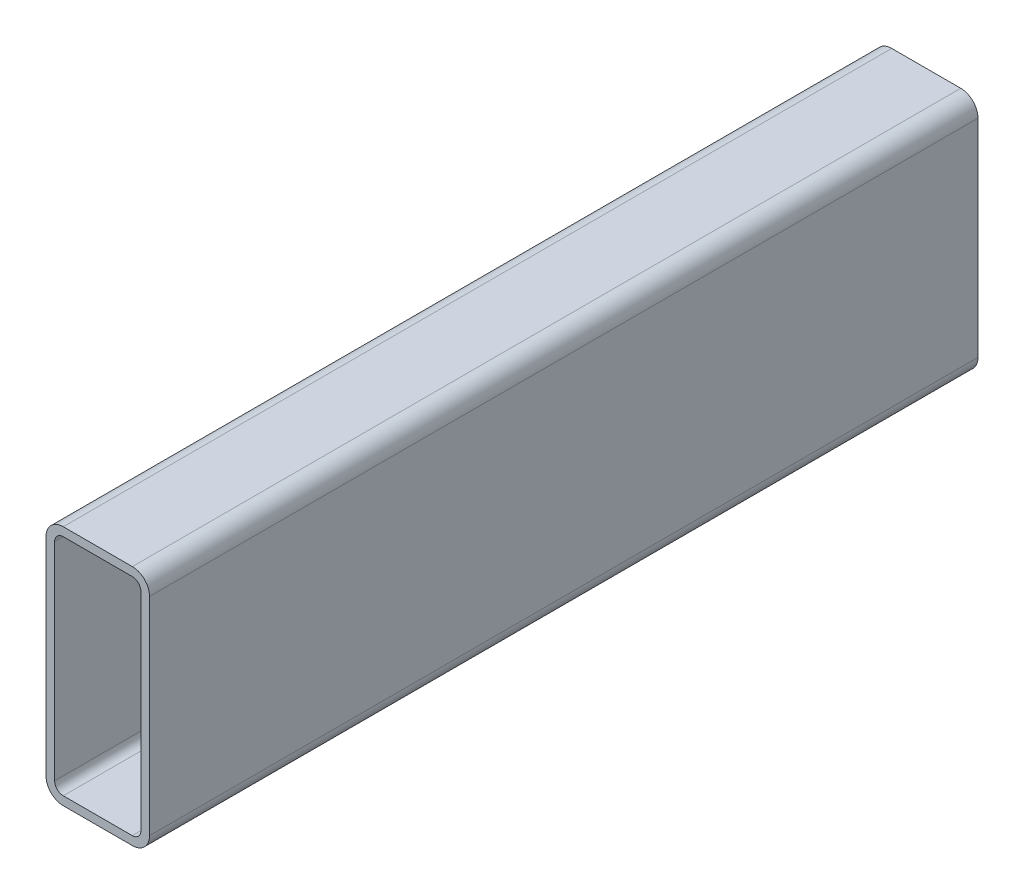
SolidWorks part; units mm, degrees
ref_plane "Front Plane" through (0, 0, 0) normal (0, 0, 1) x (1, 0, 0)
ref_plane "Top Plane" through (0, 0, 0) normal (0, 1, 0) x (1, 0, 0)
ref_plane "Right Plane" through (0, 0, 0) normal (1, 0, 0) x (0, 0, -1)
sketch "Sketch1" plane through (0, 0, 0) normal (0, 0, 1) x (1, 0, 0)
  line B0 (6.35, 88.9) -> (31.75, 88.9)
  arc B1 (38.1, 82.55) -> (31.75, 88.9) centre (31.75, 82.55) ccw
  line B2 (38.1, 82.55) -> (38.1, 6.35)
  arc B3 (31.75, 0) -> (38.1, 6.35) centre (31.75, 6.35) ccw
  line B4 (31.75, 0) -> (6.35, 0)
  arc B5 (0, 6.35) -> (6.35, 0) centre (6.35, 6.35) ccw
  line B6 (0, 6.35) -> (0, 82.55)
  arc B7 (6.35, 88.9) -> (0, 82.55) centre (6.35, 82.55) ccw
  line B8 (6.35, 85.725) -> (31.75, 85.725)
  arc B9 (34.925, 82.55) -> (31.75, 85.725) centre (31.75, 82.55) ccw
  line B10 (34.925, 82.55) -> (34.925, 6.35)
  arc B11 (31.75, 3.175) -> (34.925, 6.35) centre (31.75, 6.35) ccw
  line B12 (31.75, 3.175) -> (6.35, 3.175)
  arc B13 (3.175, 6.35) -> (6.35, 3.175) centre (6.35, 6.35) ccw
  line B14 (3.175, 6.35) -> (3.175, 82.55)
  arc B15 (6.35, 85.725) -> (3.175, 82.55) centre (6.35, 82.55) ccw
sketch_block_instance "HSS3.5x1.5x0.125-1"
sketch_block "HSS3.5x1.5x0.125"
extrude "Boss-Extrude1" add sketch "Sketch1" along normal blind 304.8
